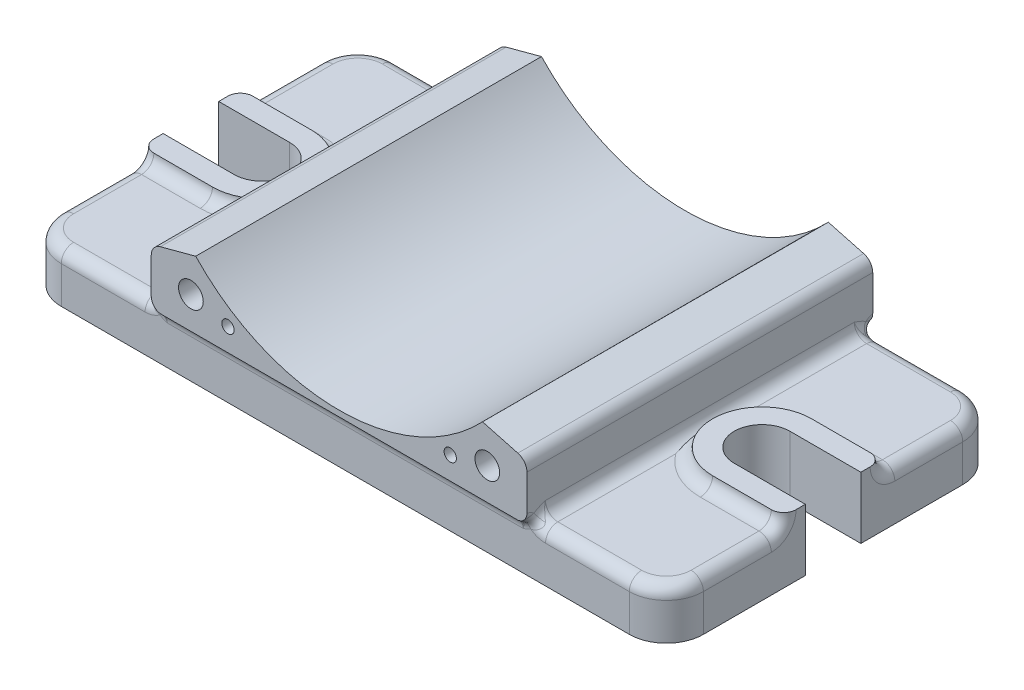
SolidWorks part; units mm, degrees
ref_plane "Front" through (0, 0, 0) normal (0, 0, 1) x (1, 0, 0)
ref_plane "Top" through (0, 0, 0) normal (0, 1, 0) x (1, 0, 0)
ref_plane "Right" through (0, 0, 0) normal (1, 0, 0) x (0, 0, -1)
sketch "Sketch3" plane through (0, 0, 0) normal (0, 1, 0) x (1, 0, 0)
  line L0 (-82.55, 42.8625) -> (82.55, 42.8625)
  line L1 (-82.55, 42.8625) -> (-82.55, -42.8625)
  line L2 (82.55, -42.8625) -> (-82.55, -42.8625)
  line L3 (82.55, -42.8625) -> (82.55, 42.8625)
  line L4 (0, 66.3895) -> (0, -72.7978) construction
  line L5 (-123.8075, 0) -> (144.0576, 0) construction
  dimension "D1" = 165.1
  dimension "D2" = 85.725
extrude "Base-Extrude" add sketch "Sketch3" against normal blind 12.7
sketch "Sketch4" plane through (0, 0, 0) normal (0, 0, 1) x (1, 0, 0)
  line L0 (-48.3014, 0) -> (48.3014, 0)
  line L1 (-48.3014, 0) -> (-48.3014, 14.2875)
  line L3 (48.3014, 14.2875) -> (48.3014, 0)
  line L5 (0, 42.6246) -> (0, -30.4166) construction
  line L6 (82.55, 0) -> (-82.55, 0) construction
  line L7 (-48.3014, 14.2875) -> (-36.8714, 17.3502)
  line L8 (36.8714, 17.3502) -> (48.3014, 14.2875)
  arc A0 (-36.8714, 17.3502) -> (36.8714, 17.3502) centre (0, 52.2949) ccw
  dimension "D1" = 50.8
  dimension "D2" = 75
  dimension "D3" = 96.6029
  dimension "D4" = 11.43
  dimension "D5" = 14.2875
extrude "Boss-Extrude1" add sketch "Sketch4" along normal mid plane 88.9
sketch "Sketch5" plane through (0, 0, 0) normal (0, 1, 0) x (-1, 0, 0)
  line L0 (82.55, -7.1437) -> (64.2937, -7.1437)
  line L1 (82.55, -7.1437) -> (82.55, 7.1437)
  line L2 (64.2937, 7.1437) -> (82.55, 7.1437)
  line L4 (82.55, -42.8625) -> (82.55, 42.8625) construction
  line L5 (85.8318, 0) -> (53.0138, 0) construction
  arc A0 (64.2937, -7.1437) -> (64.2937, 7.1437) centre (64.2937, 0) cw
  dimension "D2" = 25.4
  dimension "D1" = 14.2875
extrude "Cut-Extrude1" cut sketch "Sketch5" against normal through all
sketch "Sketch6" plane through (0, 0, 0) normal (0, 1, 0) x (-1, 0, 0)
  line L0 (82.55, 7.1437) -> (82.55, 42.8625) construction
  line L1 (64.2937, 7.1437) -> (82.55, 7.1437) construction
  line L2 (82.55, -42.8625) -> (82.55, -7.1437) construction
  line L6 (82.55, -12.7) -> (64.2937, -12.7)
  line L7 (64.2937, 12.7) -> (82.55, 12.7)
  line L9 (82.55, -7.1437) -> (64.2937, -7.1437) construction
  line L10 (82.55, 7.1437) -> (82.55, 12.7)
  line L11 (64.2937, 7.1437) -> (82.55, 7.1437)
  line L12 (82.55, -12.7) -> (82.55, -7.1437)
  line L13 (82.55, -7.1437) -> (64.2937, -7.1437)
  arc A0 (64.2937, 7.1437) -> (64.2937, -7.1437) centre (64.2937, 0) ccw construction
  arc A2 (64.2937, 12.7) -> (64.2937, -12.7) centre (64.2937, 0) ccw
  arc A3 (64.2937, 7.1437) -> (64.2937, -7.1437) centre (64.2937, 0) ccw
  dimension "D1" = 25.4
extrude "Boss-Extrude2" add sketch "Sketch6" along normal blind 3.175
other "Hole1" parameters "D1"=20.6375
sketch "Sketch7" plane through (0, 0, 44.45) normal (0, 0, 1) x (1, 0, 0)
  line L0 (0, -50) -> (0, 50) construction
  line L1 (82.55, -12.7) -> (-82.55, -12.7) construction
  circle A0 centre (-38.1, 8.2031) radius 3.175
  dimension "D1" = 6.35
  dimension "D3" = 20.9031
  dimension "D2" = 38.1
other "Hole2" parameters "D1"=14.2875
sketch "Sketch8" plane through (0, 0, 44.45) normal (0, 0, 1) x (1, 0, 0)
  line L0 (82.55, -12.7) -> (-82.55, -12.7) construction
  line L2 (0, -50) -> (0, 50) construction
  circle A0 centre (-28.575, 5.8219) radius 1.5875
  dimension "D1" = 3.175
  dimension "D2" = 18.5219
  dimension "D3" = 28.575
mirror "Mirror1" about plane through (0, 0, 0) normal (1, 0, 0) of "Boss-Extrude2", "Cut-Extrude1"
mirror "Mirror2" about plane through (0, 0, 0) normal (1, 0, 0) of "Hole2", "Hole1"
mirror "Mirror3" about plane through (0, 0, 0) normal (0, 0, 1) of "Hole1", "Hole2", "Mirror2"
fillet "Fillet1" radius 3.175 4 edges at (-48.3014, 0, 0) (48.3014, 0, 0) (-48.3014, 14.2875, 0) (48.3014, 14.2875, 0)
fillet "Fillet2" radius 3.175 6 edges at (0, 0, 42.8625) (0, 0, -42.8625) (-48.3014, 0, 43.6562) (-48.3014, 0, -43.6562) (48.3014, 0, 43.6562) (48.3014, 0, -43.6562)
fillet "Fillet3" radius 3.175 14 edges at (-82.55, 1.5875, 12.7) (-51.5937, 0, 0) (-64.2937, 1.5875, 12.7) (-64.2937, 1.5875, -12.7) (-82.55, 1.5875, -12.7) (-73.4219, 0, -12.7) (-73.4219, 0, 12.7) (73.4219, 0, -12.7) (82.55, 1.5875, -12.7) (64.2937, 1.5875, -12.7) (73.4219, 0, 12.7) (64.2937, 1.5875, 12.7) (82.55, 1.5875, 12.7) (51.5937, 0, 0)
fillet "Fillet4" radius 9.525 4 edges at (-82.55, -6.35, -42.8625) (82.55, -6.35, -42.8625) (82.55, -6.35, 42.8625) (-82.55, -6.35, 42.8625)
fillet "Fillet5" radius 3.175 20 edges at (62.2507, 0, -42.8625) (-62.2507, 0, 42.8625) (49.2314, 0.9299, -42.8625) (49.2314, 0.9299, 42.8625) (-49.2314, 0.9299, -42.8625) (-49.2314, 0.9299, 42.8625) (-82.55, 0, 24.6062) (82.55, 0, -24.6062) (-82.55, 0.9299, -13.6299) (82.55, 0.9299, -13.6299) (-82.55, 0.9299, 13.6299) (82.55, 0.9299, 13.6299) (-79.7602, 0, 40.0727) (62.2507, 0, 42.8625) (-62.2507, 0, -42.8625) (-82.55, 0, -24.6062) (-79.7602, 0, -40.0727) (79.7602, 0, -40.0727) (82.55, 0, 24.6062) (79.7602, 0, 40.0727)
fillet "Fillet9" radius 2.54 10 edges at (48.3014, -2.5369, 42.8625) (-48.3014, -2.5369, -42.8625) (-48.3014, -1.1621, 43.2879) (48.3014, -1.1621, 43.2879) (48.3014, -1.1621, -43.2879) (-48.3014, -1.1621, -43.2879) (-48.3014, -2.5369, 42.8625) (48.3014, -2.5369, -42.8625) (-48.3014, -0.7368, -42.5788) (48.3014, -0.7368, 42.5788)
fillet "Fillet10" radius 2.54 12 edges at (47.716, -0.4457, 42.6547) (-47.6535, -0.5226, 42.6903) (47.6535, -0.5226, -42.6903) (-47.716, -0.4457, -42.6547)
